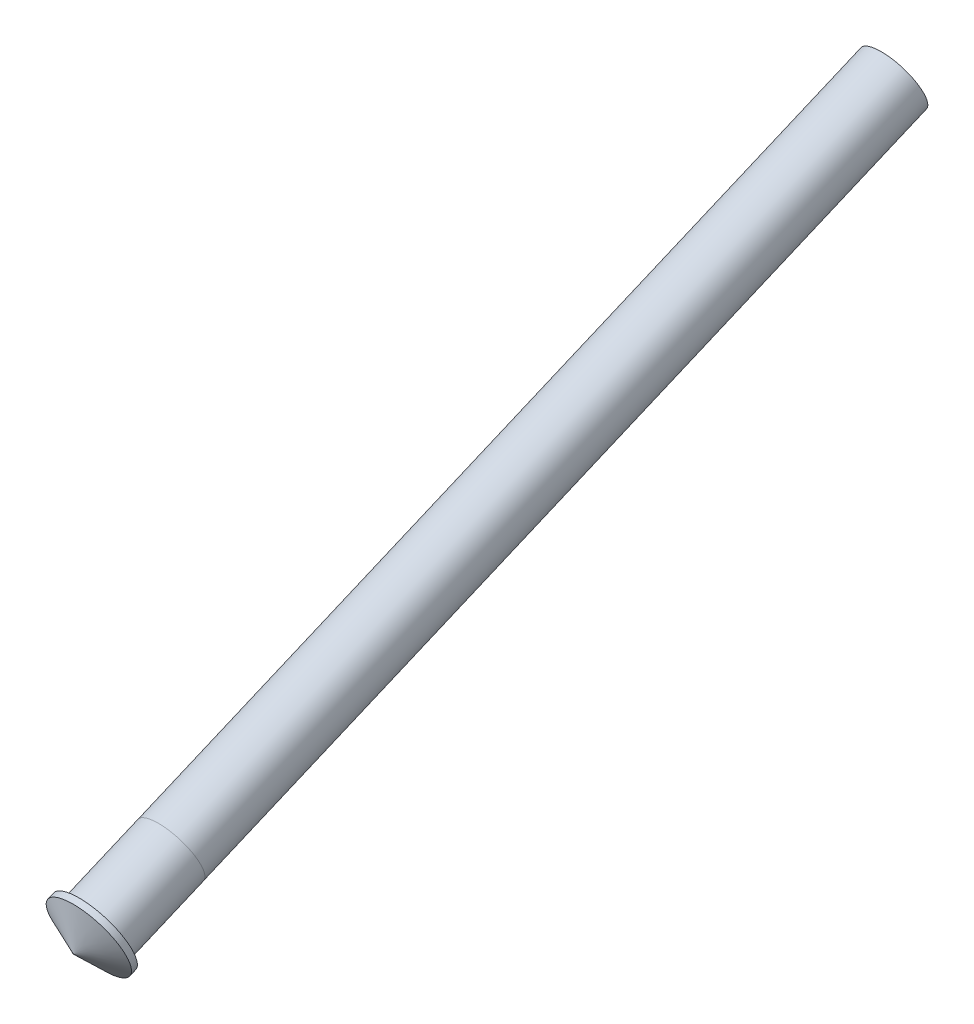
SolidWorks part; units mm, degrees
ref_plane "Front Plane" through (0, 0, 0) normal (0, 0, 1) x (1, 0, 0)
ref_plane "Top Plane" through (0, 0, 0) normal (0, 1, 0) x (1, 0, 0)
ref_plane "Right Plane" through (0, 0, 0) normal (1, 0, 0) x (0, 0, -1)
imported_body "Imported1"
sketch "Sketch1" plane through (0, 0, 0) normal (1, 0, 0) x (0, 0, -1)
  line L0 (-5.3602, 25.1839) -> (138.861, 86.4022)
  line L1 (138.861, 86.4022) -> (141.3371, 80.5687)
  line L2 (141.3371, 80.5687) -> (-2.884, 19.3504)
  line L3 (-0.4029, 13.5052) -> (-5.3651, 25.1956) construction
  line L4 (-2.884, 19.3504) -> (-5.3602, 25.1839)
  dimension "D1" = 177.8
revolve "Revolve1" add sketch "Sketch1" angle 360 about L2
